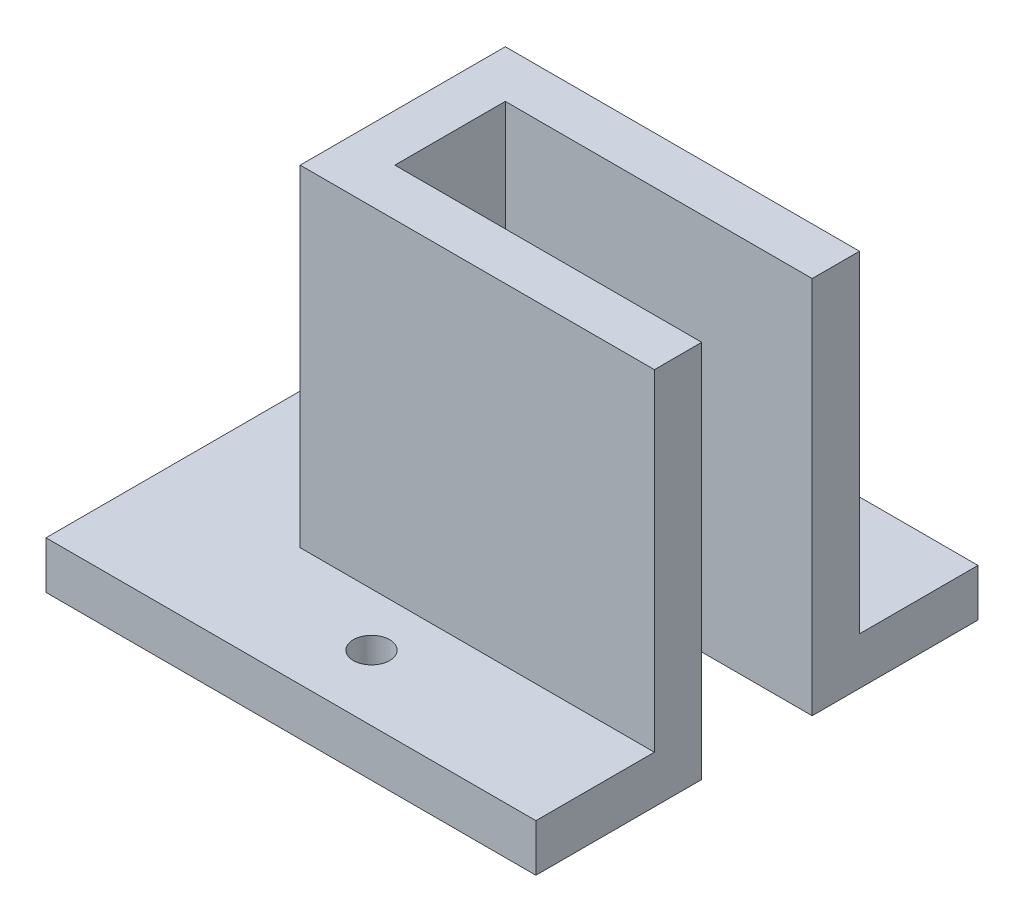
SolidWorks part; units mm, degrees
ref_plane "Front Plane" through (0, 0, 0) normal (0, 0, 1) x (1, 0, 0)
ref_plane "Top Plane" through (0, 0, 0) normal (0, 1, 0) x (1, 0, 0)
ref_plane "Right Plane" through (0, 0, 0) normal (1, 0, 0) x (0, 0, -1)
sketch "Sketch1" plane through (0, 0, 0) normal (0, 1, 0) x (1, 0, 0)
  line L1 (0, 0) -> (22.45, 0)
  line L2 (0, 0) -> (0, -13)
  line L3 (0, -13) -> (22.45, -13)
  line L4 (22.45, 0) -> (22.45, -13)
  dimension "D1" = 22.45
  dimension "D2" = 13
extrude "Boss-Extrude1" add sketch "Sketch1" along normal blind 24
sketch "Sketch2" plane through (0, 0, 0) normal (0, 1, 0) x (1, 0, 0)
  line L0 (11.225, 0) -> (11.225, -50000)
  line L1 (3, -3) -> (19.45, -3)
  line L2 (3, -3) -> (3, -10)
  line L3 (3, -10) -> (19.45, -10)
  line L4 (19.45, -3) -> (19.45, -10)
  line L5 (22.45, 0) -> (0, 0) construction
  line L6 (0, -13) -> (22.45, -13) construction
  line L7 (0, -6.5) -> (22.45, -6.5) construction
  line L8 (22.45, -13) -> (22.45, 0) construction
  line L9 (19.45, -3) -> (22.45, -3)
  line L10 (19.45, -3) -> (19.45, -10)
  line L11 (19.45, -10) -> (22.45, -10)
  line L12 (22.45, -3) -> (22.45, -10)
  line L13 (0, 0) -> (0, -13) construction
  point P8 (11.225, 0)
  point P11 (11.225, -13)
  point P14 (11.225, -3)
  point P21 (19.45, -6.5)
  dimension "D1" = 7
  dimension "D2" = 16.45
extrude "Cut-Extrude1" cut sketch "Sketch2" along normal through all contours L0 L7 L4 L1 | L7 L0 L3 L10 | L7 L2 L3 L0 | L2 L7 L0 L1 | L4 L7 L12 L9 | L7 L10 L11 L12
ref_plane "Plane1" through (0, 0, 0) normal (-1, 0, 0) x (0, 0, 1)
sketch "Sketch3" plane through (0, 0, 0) normal (-1, 0, 0) x (0, 0, 1)
  line L0 (13, 24) -> (13, 0) construction
  line L1 (0, 0) -> (13, 0)
  line L2 (0, 0) -> (0, 3)
  line L3 (0, 3) -> (13, 3)
  line L4 (13, 0) -> (13, 3)
  dimension "D1" = 3
extrude "Boss-Extrude2" add sketch "Sketch3" along normal blind 8.6
ref_plane "Plane2" through (0, 0, 13) normal (0, 0, 1) x (1, 0, 0)
ref_plane "Plane3" through (0, 3, 0) normal (0, 1, 0) x (1, 0, 0)
sketch "Sketch5" plane through (0, 3, 0) normal (0, 1, 0) x (1, 0, 0)
  line L1 (-8.6, 0) -> (0, 0) construction
  line L2 (0, 0) -> (0, -13) construction
  line L3 (-13.2, -13) -> (13.2, -13) construction
  circle A0 centre (-4.25, -6.22) radius 1.15
  dimension "D1" = 2.3
  dimension "D2" = 4.25
  dimension "D3" = 6.22
extrude "Cut-Extrude2" cut sketch "Sketch5" against normal through all
ref_plane "Plane4" through (0, 0, 13) normal (0, 0, 1) x (1, 0, 0)
sketch "Sketch6" plane through (0, 0, 13) normal (0, 0, 1) x (1, 0, 0)
  line L0 (22.45, 24) -> (22.45, 0) construction
  line L1 (-8.6, 0) -> (22.45, 0)
  line L2 (-8.6, 0) -> (-8.6, 3)
  line L3 (-8.6, 3) -> (22.45, 3)
  line L4 (22.45, 0) -> (22.45, 3)
  line L5 (4.73, 3) -> (-4.73, 3) construction
extrude "Boss-Extrude3" add sketch "Sketch6" along normal blind 7.51
sketch "Sketch7" plane through (0, 3, 0) normal (0, 1, 0) x (1, 0, 0)
  line L1 (-11.55, -13) -> (11.55, -13) construction
  line L3 (3, -3) -> (3, -10) construction
  circle A0 centre (7.88, -16.36) radius 1.15
  dimension "D1" = 2.3
  dimension "D2" = 3.36
  dimension "D3" = 4.88
extrude "Cut-Extrude3" cut sketch "Sketch7" against normal through all
ref_plane "Plane5" through (0, 0, 6.5) normal (0, 0, 1) x (1, 0, 0)
mirror "Mirror1" about plane through (0, 0, 6.5) normal (0, 0, 1) of "Boss-Extrude3"
sketch "Sketch8" plane through (0, 3, 0) normal (0, 1, 0) x (1, 0, 0)
  line L1 (22.45, 0) -> (0, 0) construction
  line L2 (3, -3) -> (3, -10) construction
  circle A0 centre (8.12, 3.64) radius 1.15
  dimension "D1" = 2.3
  dimension "D2" = 3.64
  dimension "D3" = 5.12
extrude "Cut-Extrude4" cut sketch "Sketch8" against normal through all
